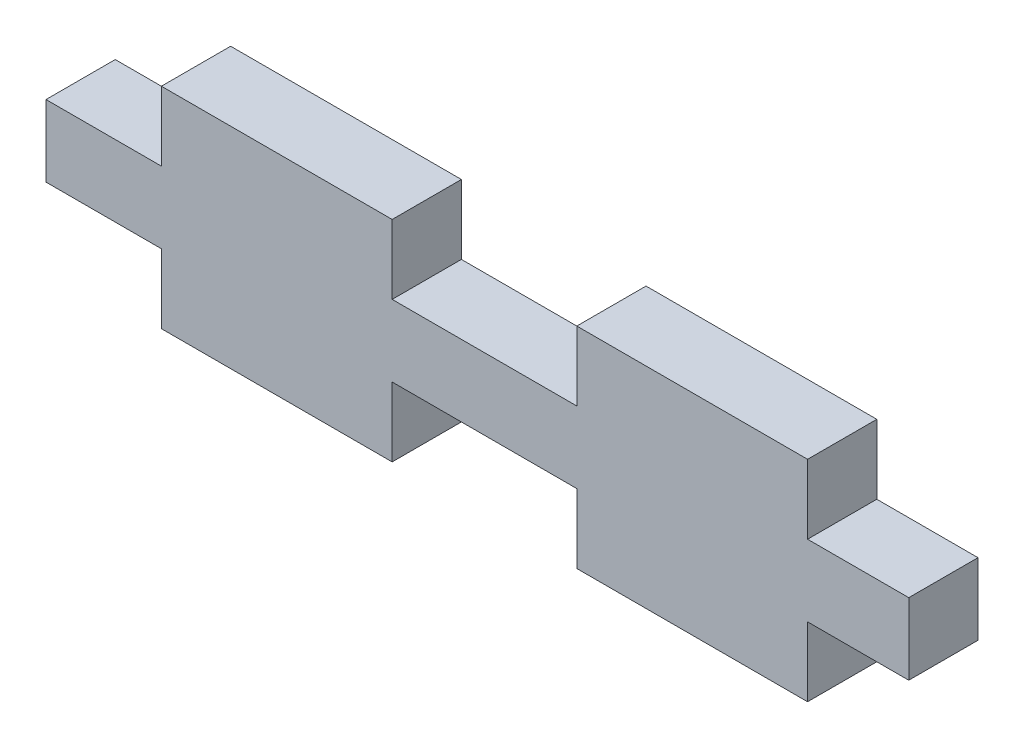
SolidWorks part; units mm, degrees
ref_plane "Plan de face" through (0, 0, 0) normal (0, 0, 1) x (1, 0, 0)
ref_plane "Plan de dessus" through (0, 0, 0) normal (0, 1, 0) x (1, 0, 0)
ref_plane "Plan de droite" through (0, 0, 0) normal (1, 0, 0) x (0, 0, -1)
sketch "Esquisse1" plane through (0, 0, 0) normal (0, 0, 1) x (1, 0, 0)
  line L0 (-45.3847, 0) -> (-40.3847, 0)
  line L1 (-40.3847, 0) -> (-40.3847, -3)
  line L2 (-40.3847, -3) -> (-30.3847, -3)
  line L3 (-30.3847, -3) -> (-30.3847, 0)
  line L4 (-30.3847, 0) -> (-22.3847, 0)
  line L5 (-22.3847, 0) -> (-22.3847, -3)
  line L6 (-22.3847, -3) -> (-12.3847, -3)
  line L7 (-12.3847, -3) -> (-12.3847, 0)
  line L8 (-12.3847, 0) -> (-8, 0)
  line L9 (-8, 0) -> (-8, 3.1)
  line L10 (-8, 3.1) -> (-12.3847, 3.1)
  line L11 (-12.3847, 3.1) -> (-12.3847, 6.1)
  line L12 (-12.3847, 6.1) -> (-22.3847, 6.1)
  line L13 (-22.3847, 6.1) -> (-22.3847, 3.1)
  line L14 (-22.3847, 3.1) -> (-30.3847, 3.1)
  line L15 (-30.3847, 3.1) -> (-30.3847, 6.1)
  line L16 (-30.3847, 6.1) -> (-40.3847, 6.1)
  line L17 (-40.3847, 6.1) -> (-40.3847, 3.1)
  line L18 (-40.3847, 3.1) -> (-45.3847, 3.1)
  line L19 (-45.3847, 3.1) -> (-45.3847, 0)
  dimension "D1" = 3.1
  dimension "D2" = 3
extrude "Boss.-Extru.1" add sketch "Esquisse1" along normal blind 3
